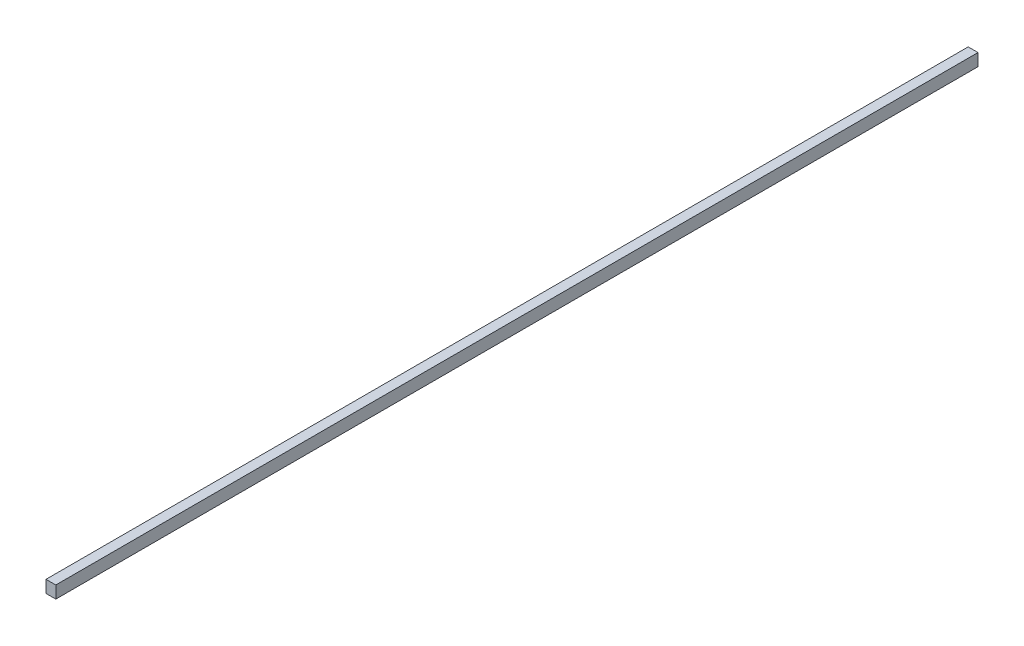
SolidWorks part; units mm, degrees
ref_plane "Front Plane" through (0, 0, 0) normal (0, 0, 1) x (1, 0, 0)
ref_plane "Top Plane" through (0, 0, 0) normal (0, 1, 0) x (1, 0, 0)
ref_plane "Right Plane" through (0, 0, 0) normal (1, 0, 0) x (0, 0, -1)
sketch "Sketch1" plane through (0, 0, 0) normal (0, 0, 1) x (1, 0, 0)
  line L1 (0, 0) -> (12.7, 0)
  line L2 (0, 0) -> (0, -15.875)
  line L3 (0, -15.875) -> (12.7, -15.875)
  line L4 (12.7, 0) -> (12.7, -15.875)
  dimension "D1" = 12.7
  dimension "D2" = 15.875
extrude "Boss-Extrude1" add sketch "Sketch1" along normal blind 1193.8
